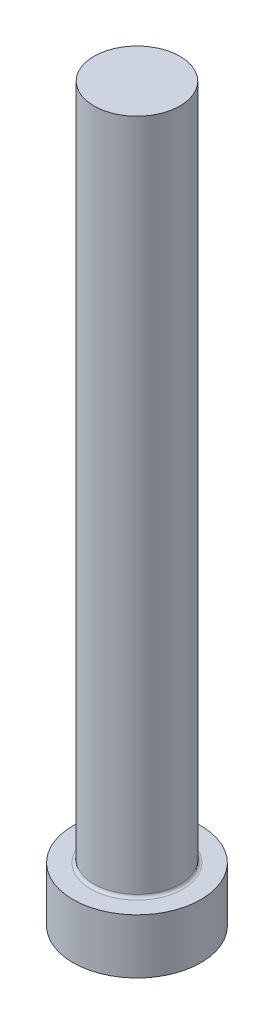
SolidWorks part; units mm, degrees
ref_plane "Front Plane" through (0, 0, 0) normal (0, 0, 1) x (1, 0, 0)
ref_plane "Top Plane" through (0, 0, 0) normal (0, 1, 0) x (1, 0, 0)
ref_plane "Right Plane" through (0, 0, 0) normal (1, 0, 0) x (0, 0, -1)
sketch "Sketch1" plane through (0, 0, 0) normal (0, 0, 1) x (1, 0, 0)
  line L0 (0, 0) -> (0, -1.906) construction
  line L1 (0, 0) -> (5.5499, 0)
  line L2 (5.5499, 0) -> (5.5499, 4.7498)
  line L3 (5.5499, 4.7498) -> (3.9878, 4.7498)
  line L4 (3.7338, 5.0038) -> (3.7338, 63.5)
  line L6 (0, 63.5) -> (3.7338, 63.5)
  line L7 (0, 63.5) -> (0, 0)
  arc A0 (3.9878, 4.7498) -> (3.7338, 5.0038) centre (3.9878, 5.0038) cw
  dimension "D5" = 0.254
  dimension "D" = 7.4676
  dimension "H" = 11.0998
  dimension "D4" = 63.5
  dimension "T" = 4.7498
revolve "Revolve3" add sketch "Sketch1" angle 360 about L0
